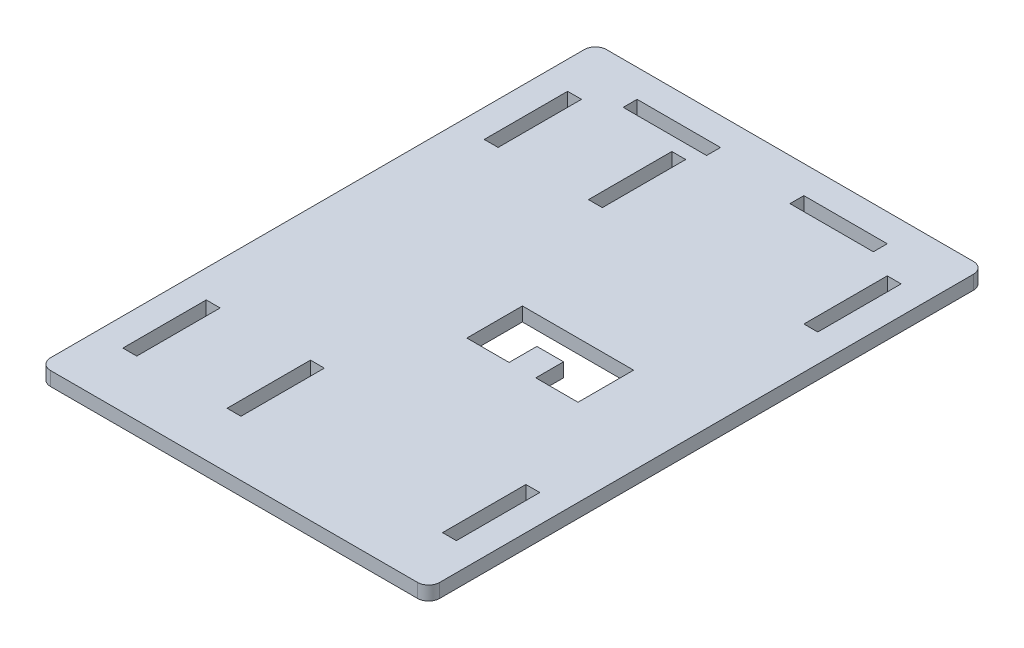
SolidWorks part; units mm, degrees
ref_plane "Front Plane" through (0, 0, 0) normal (0, 0, 1) x (1, 0, 0)
ref_plane "Top Plane" through (0, 0, 0) normal (0, 1, 0) x (1, 0, 0)
ref_plane "Right Plane" through (0, 0, 0) normal (1, 0, 0) x (0, 0, -1)
sketch "Sketch1" plane through (0, 0, 0) normal (0, 1, 0) x (1, 0, 0)
  line L0 (88.9, 0) -> (88.9, 127)
  line L1 (0, 0) -> (88.9, 0)
  line L2 (0, 0) -> (0, 127)
  line L3 (88.9, 127) -> (0, 127)
  dimension "D1" = 88.9
  dimension "D2" = 127
extrude "Boss-Extrude1" add sketch "Sketch1" along normal blind 3.175
sketch "Sketch2" plane through (0, 3.175, 0) normal (0, 1, 0) x (1, 0, 0)
  line L0 (88.9, 127) -> (0, 127) construction
  line L1 (6.35, 114.3) -> (9.525, 114.3)
  line L2 (6.35, 114.3) -> (6.35, 95.25)
  line L3 (6.35, 95.25) -> (9.525, 95.25)
  line L4 (9.525, 114.3) -> (9.525, 95.25)
  line L5 (0, 127) -> (0, 0) construction
  line L6 (44.45, 127) -> (44.45, 0) construction
  line L7 (0, 0) -> (88.9, 0) construction
  line L8 (0, 63.5) -> (88.9, 63.5) construction
  line L9 (88.9, 0) -> (88.9, 127) construction
  line L10 (79.375, 114.3) -> (79.375, 95.25)
  line L11 (82.55, 95.25) -> (79.375, 95.25)
  line L12 (82.55, 114.3) -> (82.55, 95.25)
  line L13 (82.55, 114.3) -> (79.375, 114.3)
  line L14 (82.55, 12.7) -> (79.375, 12.7)
  line L15 (82.55, 12.7) -> (82.55, 31.75)
  line L16 (82.55, 31.75) -> (79.375, 31.75)
  line L17 (79.375, 12.7) -> (79.375, 31.75)
  line L18 (9.525, 12.7) -> (9.525, 31.75)
  line L19 (6.35, 31.75) -> (9.525, 31.75)
  line L20 (6.35, 12.7) -> (6.35, 31.75)
  line L21 (6.35, 12.7) -> (9.525, 12.7)
  line L22 (53.975, 120.65) -> (53.975, 117.475)
  line L23 (15.875, 120.65) -> (34.925, 120.65)
  line L24 (15.875, 120.65) -> (15.875, 117.475)
  line L25 (15.875, 117.475) -> (34.925, 117.475)
  line L26 (34.925, 120.65) -> (34.925, 117.475)
  line L27 (73.025, 117.475) -> (53.975, 117.475)
  line L28 (73.025, 120.65) -> (73.025, 117.475)
  line L29 (73.025, 120.65) -> (53.975, 120.65)
  line L30 (33.3375, 12.7) -> (33.3375, 31.75)
  line L31 (30.1625, 114.3) -> (33.3375, 114.3)
  line L32 (30.1625, 114.3) -> (30.1625, 95.25)
  line L33 (30.1625, 95.25) -> (33.3375, 95.25)
  line L34 (33.3375, 114.3) -> (33.3375, 95.25)
  line L35 (30.1625, 31.75) -> (33.3375, 31.75)
  line L36 (30.1625, 12.7) -> (30.1625, 31.75)
  line L37 (30.1625, 12.7) -> (33.3375, 12.7)
  line L38 (31.75, 54.5792) -> (80.9625, 54.5792) construction
  line L39 (69.0562, 66.675) -> (43.6562, 66.675)
  line L40 (58.0669, 60.325) -> (58.0669, 66.675) construction
  line L41 (59.4042, 60.325) -> (53.3082, 60.325)
  line L43 (56.3562, 54.5792) -> (56.3562, 60.325) construction
  line L44 (53.3082, 60.325) -> (53.3082, 53.975)
  line L45 (53.3082, 53.975) -> (43.6562, 53.975)
  line L46 (43.6562, 53.975) -> (43.6562, 66.675)
  line L47 (69.0562, 66.675) -> (69.0562, 53.975)
  line L48 (69.0562, 53.975) -> (59.4042, 53.975)
  line L49 (59.4042, 53.975) -> (59.4042, 60.325)
  point P40 (31.75, 114.3)
  point P49 (58.0669, 63.5)
  point P52 (80.9625, 95.25)
  point P55 (31.75, 31.75)
  point P61 (56.3562, 60.325)
  dimension "D1" = 3.175
  dimension "D2" = 19.05
  dimension "D3" = 12.7
  dimension "D4" = 6.35
  dimension "D5" = 6.35
  dimension "D6" = 19.05
  dimension "D7" = 3.175
  dimension "D8" = 6.35
  dimension "D9" = 3.175
  dimension "D10" = 19.05
  dimension "D11" = 12.7
  dimension "D12" = 6.35
  dimension "D13" = 25.4
  dimension "D14" = 57.15
  dimension "D15" = 9.652
  dimension "D16" = 9.652
  dimension "D17" = 6.35
extrude "Cut-Extrude1" cut sketch "Sketch2" against normal through all
fillet "Fillet1" radius 2.54 4 edges at (88.9, 1.5875, 0) (0, 1.5875, 0) (88.9, 1.5875, -127) (0, 1.5875, -127)
